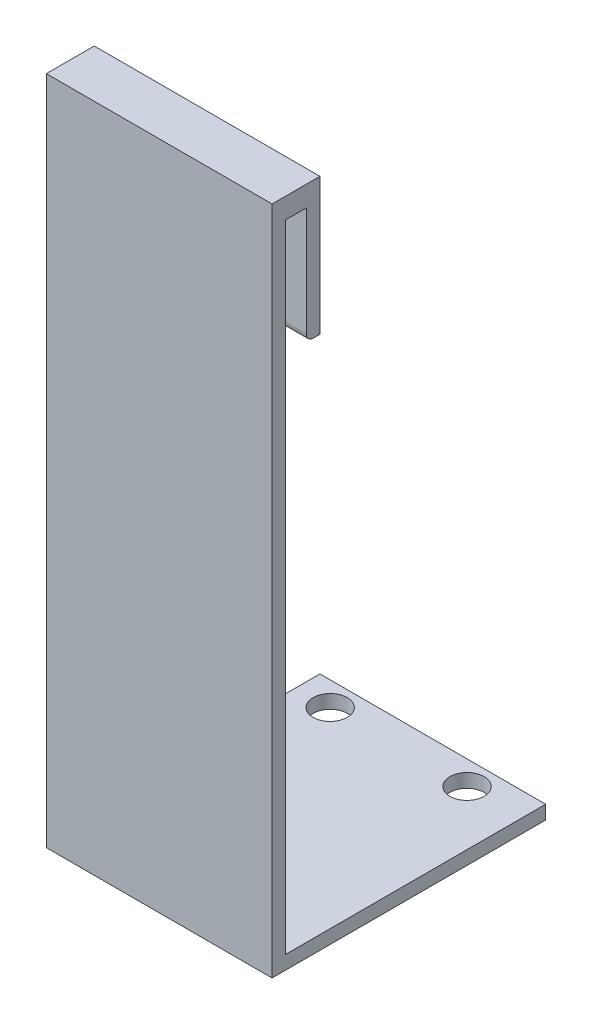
SolidWorks part; units mm, degrees
ref_plane "Front Plane" through (0, 0, 0) normal (0, 0, 1) x (1, 0, 0)
ref_plane "Top Plane" through (0, 0, 0) normal (0, 1, 0) x (1, 0, 0)
ref_plane "Right Plane" through (0, 0, 0) normal (1, 0, 0) x (0, 0, -1)
sketch "Sketch1" plane through (0, 0, 0) normal (0, 0, 1) x (1, 0, 0)
  line L0 (0, 0) -> (0, 98)
  line L1 (0, 98) -> (-33, 98)
  line L2 (-33, 98) -> (-33, 0)
  line L3 (-33, 0) -> (0, 0)
  dimension "D1" = 33
  dimension "D2" = 98
sketch "Sketch2" plane through (0, 0, 0) normal (1, 0, 0) x (0, 0, -1)
  line L0 (0, 0) -> (38, 0)
  line L4 (38, 2) -> (0, 2)
  line L5 (0, 98) -> (0, 0) construction
  line L6 (0, 2) -> (0, 0)
  line L11 (38, 2) -> (38, 0)
  dimension "D1" = 38
  dimension "D2" = 2
extrude "Boss-Extrude1" add sketch "Sketch1" along normal blind 2
extrude "Boss-Extrude2" add sketch "Sketch2" against normal blind 33
sketch "Sketch5" plane through (0, 2, 0) normal (0, 1, 0) x (1, 0, 0)
  line L2 (-33, 38) -> (-33, 0) construction
  line L3 (0, 38) -> (0, 0) construction
  circle A0 centre (-28, 34.5) radius 2.5
  circle A1 centre (-8, 34.5) radius 2.5
  dimension "D1" = 5
  dimension "D2" = 5
  dimension "D4" = 5
  dimension "D5" = 8
  dimension "D6" = 34.5
sketch "Sketch6" plane through (0, 0, 0) normal (1, 0, 0) x (0, 0, -1)
  line L0 (0, 98) -> (5, 98)
  line L1 (5, 98) -> (5, 78)
  line L2 (5, 78) -> (3, 78)
  line L3 (3, 78) -> (3, 95)
  line L4 (3, 95) -> (0, 95)
  line L5 (0, 2) -> (0, 98) construction
  line L6 (0, 95) -> (0, 98)
  dimension "D1" = 2
  dimension "D2" = 3
  dimension "D3" = 20
  dimension "D4" = 3
extrude "Boss-Extrude4" add sketch "Sketch6" against normal blind 33
fillet "Fillet1" radius 1 1 edges at (-16.5, 78, -3)
extrude "Cut-Extrude1" cut sketch "Sketch5" against normal blind 10
scale "Scale1" scale about centroid uniform scaling yes scale factor 0.8
